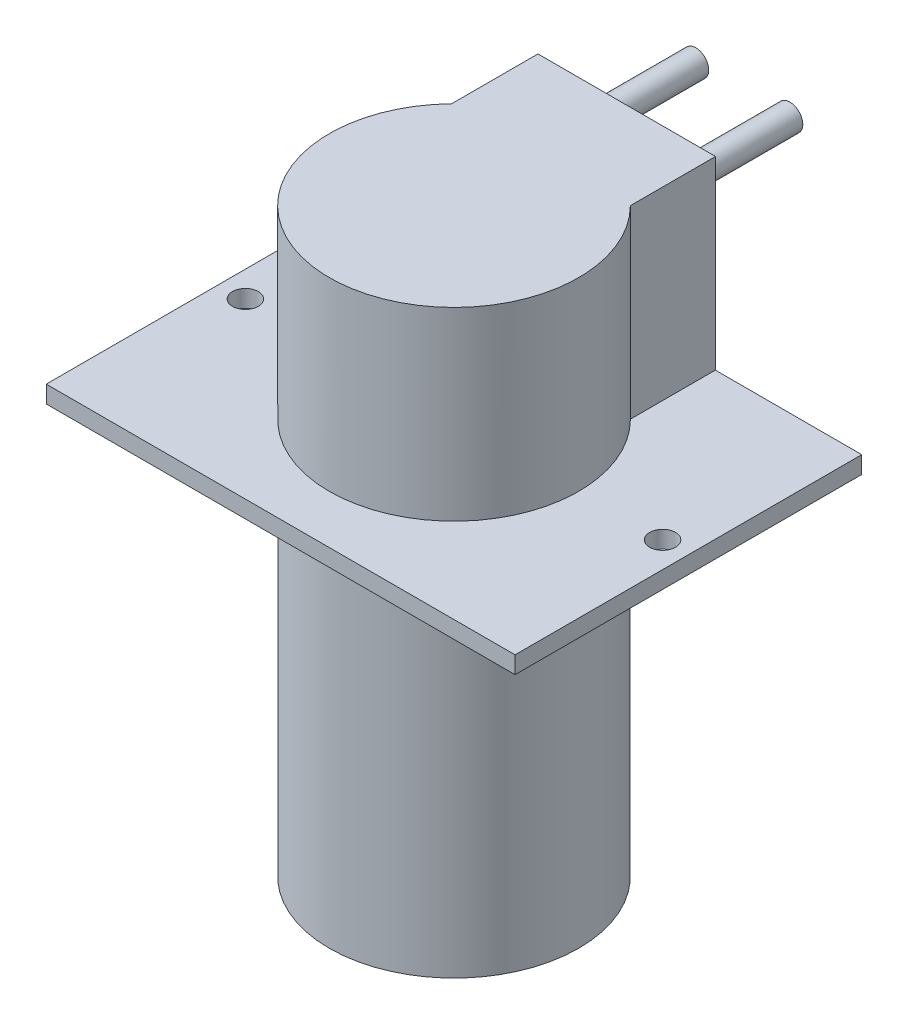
SolidWorks part; units mm, degrees
ref_plane "前视基准面" through (0, 0, 0) normal (0, 0, 1) x (1, 0, 0)
ref_plane "上视基准面" through (0, 0, 0) normal (0, 1, 0) x (1, 0, 0)
ref_plane "右视基准面" through (0, 0, 0) normal (1, 0, 0) x (0, 0, -1)
other "Configuration Table"
sketch "草图1" plane through (0, 0, 0) normal (0, 1, 0) x (1, 0, 0)
  circle A0 centre (0, 0) radius 14.5
extrude "凸台-拉伸1" add sketch "草图1" along normal blind 44
sketch "草图2" plane through (0, 44, 0) normal (0, 1, 0) x (1, 0, 0)
  line L1 (-27.25, -20.15) -> (27.25, -20.15)
  line L2 (-27.25, -20.15) -> (-27.25, 20.15)
  line L3 (-27.25, 20.15) -> (27.25, 20.15)
  line L4 (27.25, -20.15) -> (27.25, 20.15)
  line L5 (-27.25, -20.15) -> (27.25, 20.15) construction
  line L6 (-27.25, 20.15) -> (27.25, -20.15) construction
  point P0 (0, 0)
  dimension "D1" = 54.5
  dimension "D2" = 40.3
extrude "凸台-拉伸2" add sketch "草图2" along normal blind 2
sketch "草图3" plane through (0, 46, 0) normal (0, 1, 0) x (1, 0, 0)
  circle A0 centre (0, 0) radius 14.5
extrude "凸台-拉伸3" add sketch "草图3" along normal blind 21.5225
sketch "草图4" plane through (0, 46, 0) normal (0, 1, 0) x (1, 0, 0)
  circle A0 centre (-24.25, 0) radius 1.5
  circle A1 centre (24.25, 0) radius 1.5
extrude "切除-拉伸1" cut sketch "草图4" against normal blind 23.5
sketch "草图5" plane through (0, 67.5225, 0) normal (0, 1, 0) x (1, 0, 0)
  line L0 (27.25, 20.15) -> (-27.25, 20.15) construction
  line L1 (-10.3925, 10.1116) -> (10.2545, 10.1116)
  line L2 (-10.3925, 10.1116) -> (-10.3925, 20.15)
  line L3 (-10.3925, 20.15) -> (10.2545, 20.15)
  line L4 (10.2545, 10.1116) -> (10.2545, 20.15)
  circle A0 centre (0, 0) radius 14.5 construction
extrude "凸台-拉伸4" add sketch "草图5" against normal blind 21.5
sketch "草图6" plane through (0, 0, -20.15) normal (0, 0, -1) x (-1, 0, 0)
  circle A0 centre (-5.3971, 62.3214) radius 1.5
  circle A1 centre (5.5355, 62.3214) radius 1.5
extrude "凸台-拉伸5" add sketch "草图6" along normal blind 13.5
